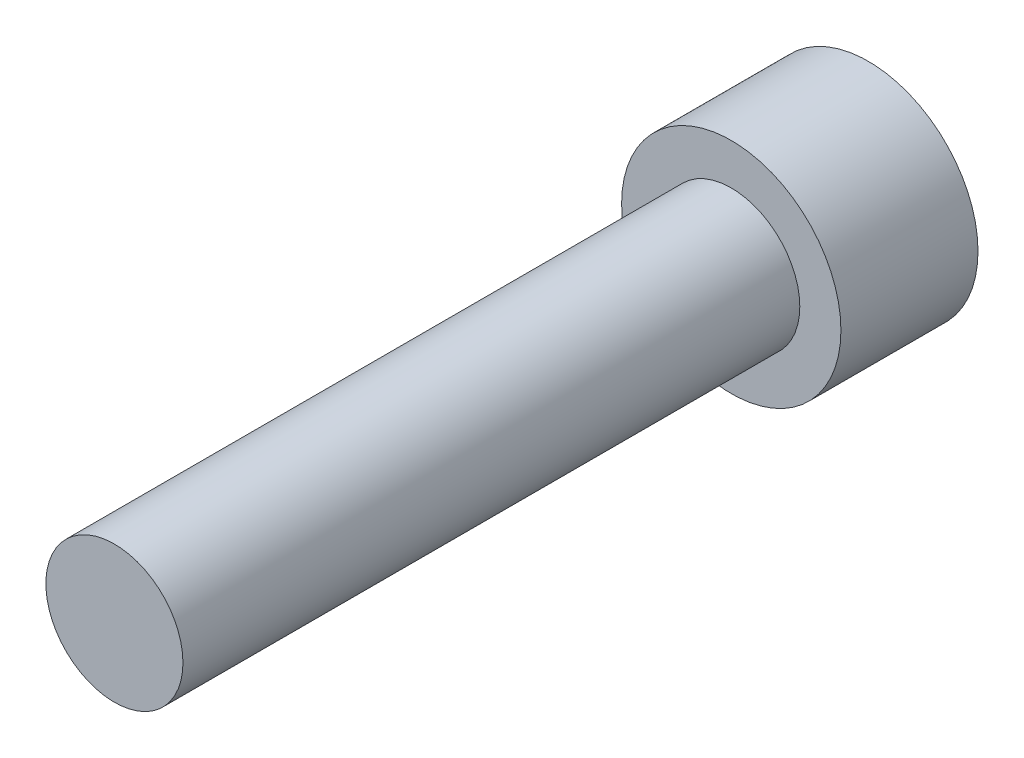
SolidWorks part; units mm, degrees
ref_plane "Front Plane" through (0, 0, 0) normal (0, 0, 1) x (1, 0, 0)
ref_plane "Top Plane" through (0, 0, 0) normal (0, 1, 0) x (1, 0, 0)
ref_plane "Right Plane" through (0, 0, 0) normal (1, 0, 0) x (0, 0, -1)
sketch "Sketch6" plane through (0, 0, 0) normal (1, 0, 0) x (0, 0, -1)
  line L0 (-45, 0) -> (22.525, 0) construction
  line L1 (8.8, 0) -> (-8.8, 0) construction
  line L2 (-45, 0) -> (-45, -5)
  line L3 (-45, -5) -> (0, -5)
  line L4 (0, 8.8) -> (0, -8.8) construction
  line L5 (0, -5) -> (0, -8)
  line L6 (0, -8) -> (10, -8)
  line L7 (10, -8) -> (10, 0)
  line L8 (10, 0) -> (-45, 0)
  dimension "L" = 45
  dimension "H" = 10
  dimension "A" = 16
  dimension "D" = 10
revolve "Revolve1" add sketch "Sketch6" angle 360 about L0
sketch "Sketch7" plane through (0, 0, -10) normal (0, 0, -1) x (-1, 0, 0)
  line L2 (-4, 2.3094) -> (-4, -2.3094)
  line L4 (-4, -2.3094) -> (0, -4.6188)
  line L5 (0, -4.6188) -> (4, -2.3094)
  line L6 (4, -2.3094) -> (4, 2.3094)
  line L7 (4, 2.3094) -> (0, 4.6188)
  line L8 (0, 4.6188) -> (-4, 2.3094)
  circle A0 centre (0, 0) radius 4 construction
  dimension "J" = 8
extrude "HEX" cut sketch "Sketch7" against normal blind 8
